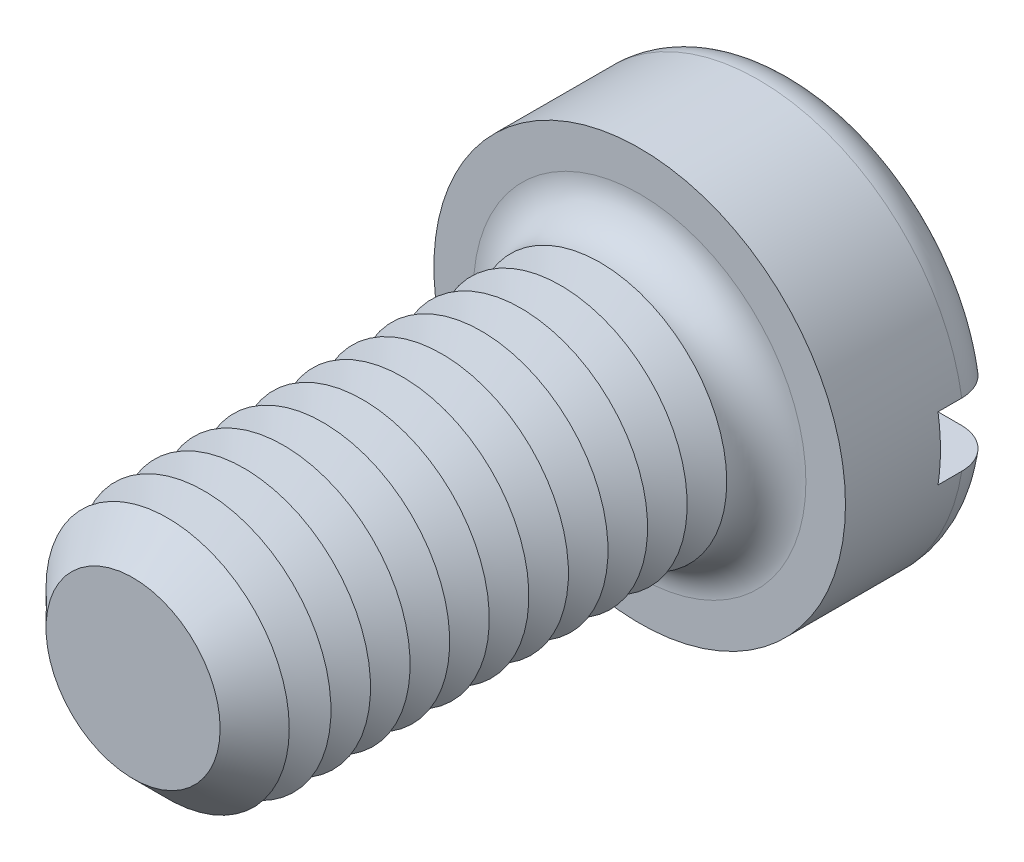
SolidWorks part; units mm, degrees
ref_plane "Front Plane" through (0, 0, 0) normal (0, 0, 1) x (1, 0, 0)
ref_plane "Top Plane" through (0, 0, 0) normal (0, 1, 0) x (1, 0, 0)
ref_plane "Right Plane" through (0, 0, 0) normal (1, 0, 0) x (0, 0, -1)
sketch "Sketch3" plane through (0, 0, 0) normal (0, 0, 1) x (1, 0, 0)
  circle A0 centre (0, 0) radius 6.5
  dimension "D1" = 13
extrude "Boss-Extrude2" add sketch "Sketch3" against normal blind 5
sketch "Sketch4" plane through (0, 0, 0) normal (0, 0, 1) x (1, 0, 0)
  circle A0 centre (0, 0) radius 4
  dimension "D1" = 8
extrude "Boss-Extrude3" add sketch "Sketch4" along normal blind 16
fillet "Fillet1" radius 1.25 2 edges at (6.5, 0, -5) (4, 0, 0)
chamfer "Chamfer1" distance 1.25 angle 45 1 edges at (4, 0, 16)
sketch "Sketch5" plane through (0, 0, 0) normal (1, 0, 0) x (0, 0, -1)
  line L0 (1.6944, 0) -> (-7.6738, 0) construction
sketch "Sketch6" plane through (0, 0, 0) normal (1, 0, 0) x (0, 0, -1)
  line L0 (-1.25, 4) -> (-1.875, 2.9175)
  line L1 (-1.875, 2.9175) -> (-2.5, 4)
  line L2 (-1.25, 4) -> (-14.75, 4) construction
  line L3 (-2.5, 4) -> (-1.25, 4)
  dimension "D1" = 1.25
revolve "Cut-Revolve1" cut sketch "Sketch6" angle 360 about L0
pattern_linear "LPattern1" count 11 spacing 1.25 along (0, 0, 1) of "Cut-Revolve1"
sketch "Sketch8" plane through (0, 0, -5) normal (0, 0, -1) x (-1, 0, 0)
  line L1 (6.5, -1) -> (-6.5, -1)
  line L2 (6.5, -1) -> (6.5, 1)
  line L3 (6.5, 1) -> (-6.5, 1)
  line L4 (-6.5, -1) -> (-6.5, 1)
  line L5 (6.5, -1) -> (-6.5, 1) construction
  line L6 (6.5, 1) -> (-6.5, -1) construction
  point P0 (0, 0)
  dimension "D1" = 13
  dimension "D2" = 2
extrude "Cut-Extrude1" cut sketch "Sketch8" against normal blind 2
